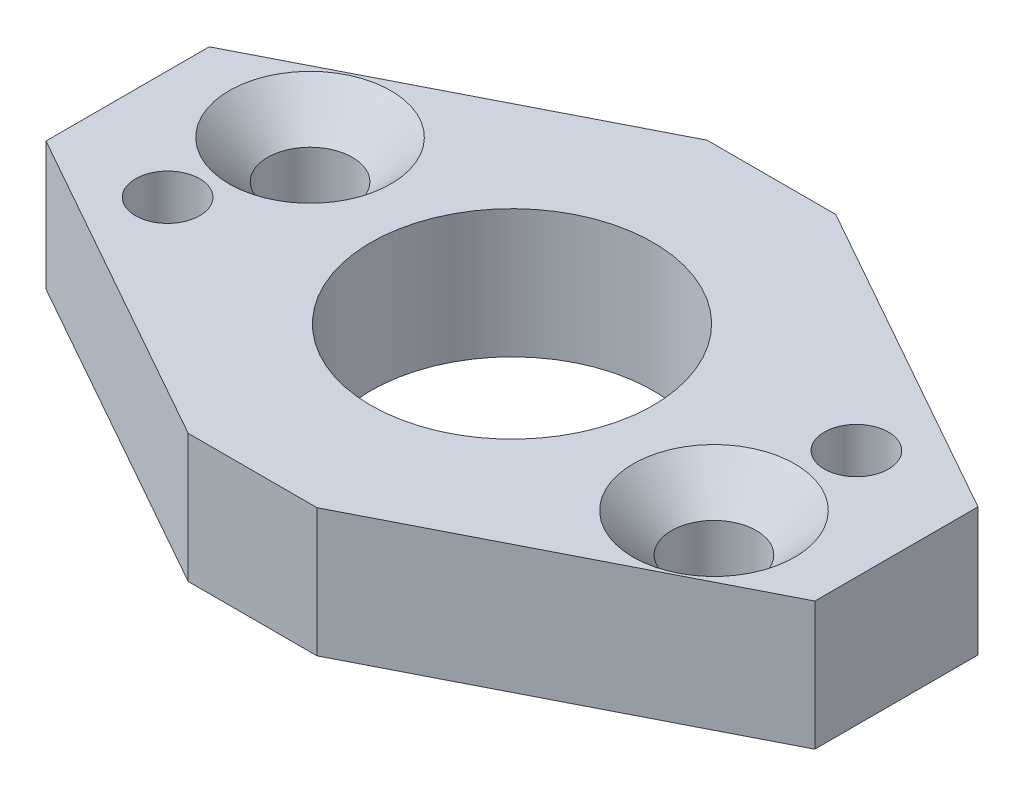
SolidWorks part; units mm, degrees
ref_plane "正面" through (0, 0, 0) normal (0, 0, 1) x (1, 0, 0)
ref_plane "平面" through (0, 0, 0) normal (0, 1, 0) x (1, 0, 0)
ref_plane "右側面" through (0, 0, 0) normal (1, 0, 0) x (0, 0, -1)
sketch "ｽｹｯﾁ1" plane through (0, 0, 0) normal (0, 1, 0) x (1, 0, 0)
  line L0 (0, 20) -> (0, 0) construction
  line L1 (-30.5, 20) -> (30.5, 20)
  line L2 (-30.5, 20) -> (-30.5, -20)
  line L3 (-30.5, -20) -> (30.5, -20)
  line L4 (30.5, 20) -> (30.5, -20)
  line L5 (0, 0) -> (-30.5, 0) construction
  dimension "D1" = 40
  dimension "D2" = 61
extrude "ﾎﾞｽ - 押し出し1" add sketch "ｽｹｯﾁ1" along normal blind 10
sketch "ｽｹｯﾁ2" plane through (0, 10, 0) normal (0, 1, 0) x (1, 0, 0)
  circle A0 centre (0, 0) radius 11
  dimension "D1" = 22
extrude "ｶｯﾄ - 押し出し1" cut sketch "ｽｹｯﾁ2" against normal through all
hole_wizard "M6x1.0 ねじ穴1" positions "ｽｹｯﾁ3" profile "ｽｹｯﾁ4" tap size "M6x1.0" standard "JIS"
sketch "ｽｹｯﾁ3" plane through (0, 10, 0) normal (0, 1, 0) x (1, 0, 0)
  line L1 (-21.9667, -4.8699) -> (0, 0) construction
  line L2 (0, 0) -> (-1.4768, 6.6615) construction
  line L4 (0, 0) -> (-26.8372, 0) construction
  point P0 (-21.9667, -4.8699)
  point P2 (21.9667, 4.8699)
  dimension "D1" = 45
  dimension "D2" = 12.5
sketch "ｽｹｯﾁ4" plane through (-21.9667, 10, 4.8699) normal (1, 0, 0) x (0, 0, 1)
  line L0 (0, 0) -> (0, 10)
  line L1 (0, 10) -> (2.5, 10)
  line L2 (2.5, 10) -> (2.5, 0)
  line L5 (2.5, 0) -> (0, 0)
  line L11 (0, -6.35) -> (0, 107.95) construction
  dimension "次ｻｰﾌｪｽまでのねじ下穴ﾄﾞﾘﾙ直径" = 5
  dimension "次ｻｰﾌｪｽまでのねじ下穴ﾄﾞﾘﾙの深さ" = 10
hole_wizard "M6 平皿頭ねじ用皿穴2" positions "ｽｹｯﾁ5" profile "ｽｹｯﾁ6" countersink size "M6" standard "JIS"
sketch "ｽｹｯﾁ5" plane through (0, 10, 0) normal (0, 1, 0) x (1, 0, 0)
  line L0 (-20.4618, 4.724) -> (20.4618, -4.724) construction
  line L1 (0, 0) -> (21.9667, 4.8699) construction
  point P6 (20.4618, -4.724)
  point P8 (-20.4618, 4.724)
  dimension "D1" = 42
  dimension "D2" = 25.5
sketch "ｽｹｯﾁ6" plane through (-20.4618, 10, -4.724) normal (1, 0, 0) x (0, 0, 1)
  line L0 (0, 0) -> (0, 10)
  line L1 (0, 10) -> (3.3, 10)
  line L2 (3.3, 10) -> (3.3, 3)
  line L3 (3.3, 3) -> (6.3, 0)
  line L5 (6.3, 0) -> (0, 0)
  line L6 (-3.3, 3) -> (-6.3, 0) construction
  line L11 (0, -6.35) -> (0, 107.95) construction
  dimension "通し穴の直径" = 6.6
  dimension "通し穴の深さ" = 10
  dimension "表面の皿穴の直径" = 12.6
  dimension "表面の皿穴の角度" = 90
sketch "ｽｹｯﾁ7" plane through (0, 10, 0) normal (0, 1, 0) x (1, 0, 0)
  line L0 (-30.5, 6.9035) -> (-4.8025, 20)
  line L1 (-30.5, 20) -> (-30.5, -20) construction
  line L2 (30.5, 20) -> (-30.5, 20) construction
  line L3 (-4.8025, 20) -> (-30.5, 20)
  line L4 (-30.5, 20) -> (-30.5, 6.9035)
  line L5 (5.2302, 20) -> (30.5, 20)
  line L6 (30.5, -20) -> (30.5, 20) construction
  line L7 (30.5, 20) -> (30.5, 5.8133)
  line L8 (30.5, 5.8133) -> (5.2302, 20)
  circle A0 centre (0, 0) radius 20 construction
  circle A1 centre (21.9667, 4.8699) radius 5 construction
  circle A2 centre (-20.4618, 4.724) radius 6.5 construction
  dimension "D1" = 40
  dimension "D2" = 10
  dimension "D3" = 13
extrude "ｶｯﾄ - 押し出し2" cut sketch "ｽｹｯﾁ7" against normal through all
pattern_circular "円形ﾊﾟﾀｰﾝ1" count 2 over 360 about axis through (0, 0, 0) along (0, 1, 0) of "ｶｯﾄ - 押し出し2"
